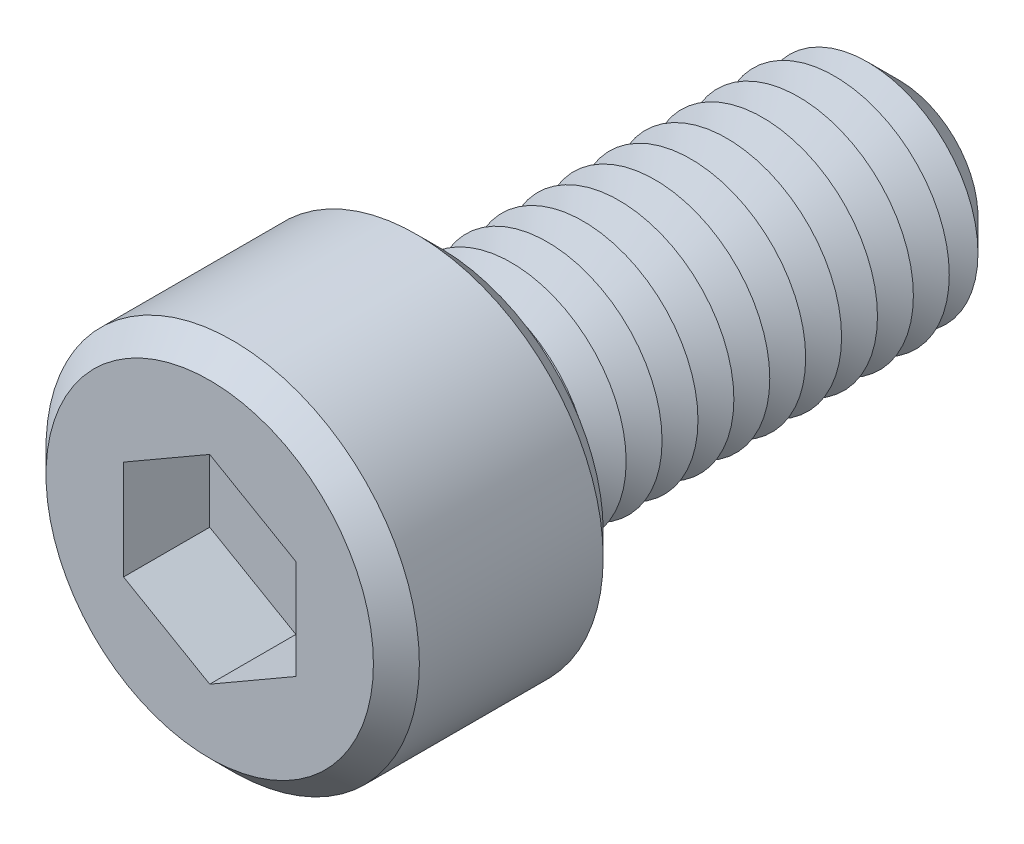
SolidWorks part; units mm, degrees
ref_plane "Front Plane" through (0, 0, 0) normal (0, 0, 1) x (1, 0, 0)
ref_plane "Top Plane" through (0, 0, 0) normal (0, 1, 0) x (1, 0, 0)
ref_plane "Right Plane" through (0, 0, 0) normal (1, 0, 0) x (0, 0, -1)
sketch "Sketch1" plane through (0, 0, 0) normal (0, 0, 1) x (1, 0, 0)
  circle A0 centre (0, 0) radius 6.5
  dimension "D1" = 13
extrude "Boss-Extrude1" add sketch "Sketch1" along normal blind 8
sketch "Sketch2" plane through (0, 0, 0) normal (0, 0, -1) x (-1, 0, 0)
  circle A0 centre (0, 0) radius 4
  dimension "D1" = 8
extrude "Boss-Extrude2" add sketch "Sketch2" along normal blind 16
chamfer "Chamfer1" distance 1.25 angle 45 1 edges at (-4, 0, -16)
sketch "Sketch3" plane through (0, 0, 0) normal (1, 0, 0) x (0, 0, -1)
  line L0 (-2.5121, 0) -> (4.5776, 0) construction
sketch "Sketch4" plane through (0, 0, 0) normal (1, 0, 0) x (0, 0, -1)
  line L0 (0, 4) -> (0.625, 2.9175)
  line L1 (0.625, 2.9175) -> (1.25, 4)
  line L2 (14.75, 4) -> (0, 4) construction
  line L3 (1.25, 4) -> (0, 4)
  dimension "D1" = 1.25
revolve "Cut-Revolve1" cut sketch "Sketch4" angle 360 about L0
pattern_linear "LPattern1" count 12 spacing 1.25 along (0, 0, -1) of "Cut-Revolve1"
sketch "Sketch5" plane through (0, 0, 8) normal (0, 0, 1) x (1, 0, 0)
  line L1 (0, 3.4641) -> (-3, 1.7321)
  line L2 (-3, 1.7321) -> (-3, -1.7321)
  line L3 (-3, -1.7321) -> (0, -3.4641)
  line L4 (0, -3.4641) -> (3, -1.7321)
  line L5 (3, -1.7321) -> (3, 1.7321)
  line L6 (3, 1.7321) -> (0, 3.4641)
  circle A0 centre (0, 0) radius 3 construction
  dimension "D1" = 6
extrude "Cut-Extrude1" cut sketch "Sketch5" against normal blind 3
sketch "Sketch6" plane through (0, 0, 5) normal (0, 0, 1) x (1, 0, 0)
  circle A0 centre (0, 0) radius 0.9
  dimension "D1" = 1.8
extrude "Cut-Extrude2" cut sketch "Sketch6" against normal up to surface (21 mm away)
chamfer "Chamfer2" distance 0.8 angle 45 2 edges at (6.5, 0, 0) (6.5, 0, 8)
